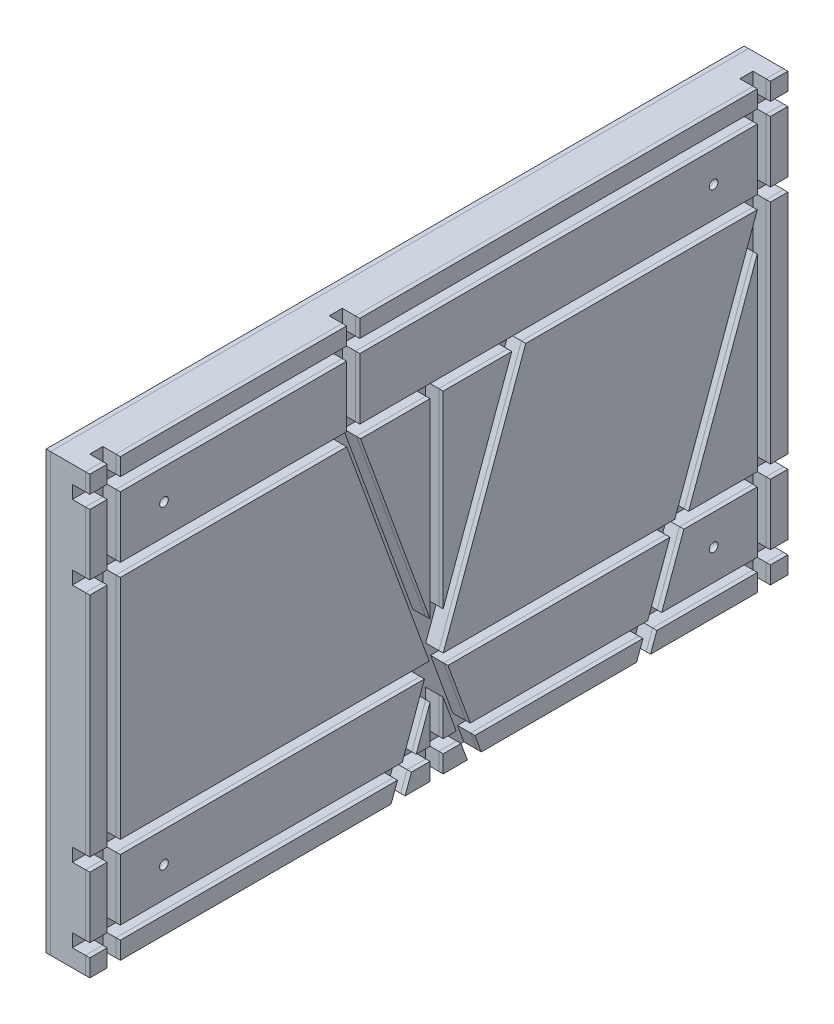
SolidWorks part; units mm, degrees
ref_plane "Plan de face" through (0, 0, 0) normal (0, 0, 1) x (1, 0, 0)
ref_plane "Plan de dessus" through (0, 0, 0) normal (0, 1, 0) x (1, 0, 0)
ref_plane "Plan de droite" through (0, 0, 0) normal (1, 0, 0) x (0, 0, -1)
sketch "Esquisse1" plane through (0, 0, 0) normal (1, 0, 0) x (0, 0, -1)
  line L1 (0, 0) -> (160, 0)
  line L2 (0, 0) -> (0, 100)
  line L3 (0, 100) -> (160, 100)
  line L4 (160, 0) -> (160, 100)
  dimension "D1" = 160
  dimension "D2" = 100
extrude "Extrusion1" add sketch "Esquisse1" against normal blind 1
sketch "Esquisse2" plane through (-1, 0, 0) normal (1, 0, 0) x (0, 0, -1)
  line L1 (160, 100) -> (0, 100)
  line L2 (160, 100) -> (160, 0)
  line L3 (160, 0) -> (0, 0)
  line L4 (0, 100) -> (0, 0)
extrude "Extrusion4" add sketch "Esquisse2" against normal blind 8 separate body
sketch "Esquisse4" plane through (-9, 0, 0) normal (-1, 0, 0) x (0, 0, 1)
  line L1 (0, 100) -> (-160, 100)
  line L2 (0, 100) -> (0, 0)
  line L3 (0, 0) -> (-160, 0)
  line L4 (-160, 100) -> (-160, 0)
extrude "Extrusion5" add sketch "Esquisse4" along normal blind 1 separate body
sketch "Esquisse5" plane through (0, 0, 0) normal (1, 0, 0) x (0, 0, -1)
  line L0 (160, 0) -> (160, 100) construction
  line L1 (156, 108.4085) -> (153, 108.4085)
  line L2 (156, 108.4085) -> (156, -9.5945)
  line L3 (156, -9.5945) -> (153, -9.5945)
  line L4 (153, 108.4085) -> (153, -9.5945)
  line L5 (0, 100) -> (0, 0) construction
  line L10 (7, 107.0249) -> (4, 107.0249)
  line L11 (7, 107.0249) -> (7, -7.0249)
  line L12 (7, -7.0249) -> (4, -7.0249)
  line L13 (4, 107.0249) -> (4, -7.0249)
  line L14 (0, 0) -> (160, 0) construction
  line L15 (81, 78) -> (78, 78)
  line L16 (81, 78) -> (81, -9.5945)
  line L17 (81, -9.5945) -> (78, -9.5945)
  line L18 (78, 78) -> (78, -9.5945)
  dimension "D1" = 3
  dimension "D2" = 4
  dimension "D4" = 3
  dimension "D5" = 4
  dimension "D7" = 3
  dimension "D8" = 79
  dimension "D9" = 78
extrude "Enlèv. mat.-Extru.1" cut sketch "Esquisse5" against normal blind 4
sketch "Esquisse6" plane through (0, 0, 0) normal (1, 0, 0) x (0, 0, -1)
  line L1 (165.6856, 96) -> (-8.2552, 96)
  line L2 (165.6856, 96) -> (165.6856, 93)
  line L3 (165.6856, 93) -> (-8.2552, 93)
  line L4 (-8.2552, 96) -> (-8.2552, 93)
  line L6 (164.4997, 79) -> (-14.778, 79)
  line L7 (164.4997, 79) -> (164.4997, 76)
  line L8 (164.4997, 76) -> (-14.778, 76)
  line L9 (-14.778, 79) -> (-14.778, 76)
  line L10 (168.0576, 4) -> (-9.6388, 4)
  line L11 (168.0576, 4) -> (168.0576, 7)
  line L12 (168.0576, 7) -> (-9.6388, 7)
  line L13 (-9.6388, 4) -> (-9.6388, 7)
  line L14 (7, 0) -> (153, 0) construction
  line L16 (165.6856, 24) -> (-9.6388, 24)
  line L17 (165.6856, 24) -> (165.6856, 21)
  line L18 (165.6856, 21) -> (-9.6388, 21)
  line L19 (-9.6388, 24) -> (-9.6388, 21)
  dimension "D1" = 3
  dimension "D4" = 3
  dimension "D5" = 3
  dimension "D6" = 4
  dimension "D7" = 3
  dimension "D8" = 21
extrude "Enlèv. mat.-Extru.3" cut sketch "Esquisse6" against normal blind 4
sketch "Esquisse7" plane through (0, 0, 0) normal (1, 0, 0) x (0, 0, -1)
  line L0 (125.3383, 0) -> (153, 76)
  line L1 (81, 0) -> (153, 0) construction
  line L2 (153, 76) -> (153, 24) construction
  line L3 (153.9311, 69.7867) -> (128.2731, -0.708)
  line L5 (128.2731, -0.708) -> (125.3383, 0)
  line L6 (153, 76) -> (153.9311, 69.7867)
  line L7 (81, 24) -> (99.9265, 76)
  line L8 (81, 76) -> (153, 76) construction
  line L9 (81, 24) -> (81, 76) construction
  line L10 (97.398, 77.8245) -> (68.7961, -0.7586)
  line L11 (81, 24) -> (72.2647, 0)
  line L12 (7, 0) -> (78, 0) construction
  line L13 (78, 21) -> (78, 7) construction
  line L14 (97.398, 77.8245) -> (99.9265, 76)
  line L15 (68.7961, -0.7586) -> (72.2647, 0)
  dimension "D1" = 20
  dimension "D2" = 3
  dimension "D3" = 20
  dimension "D4" = 3
  dimension "D5" = 20
extrude "Enlèv. mat.-Extru.4" cut sketch "Esquisse7" against normal blind 4
sketch "Esquisse8" plane through (0, 0, 0) normal (1, 0, 0) x (0, 0, -1)
  line L0 (58.881, 76) -> (86.5428, 0)
  line L1 (7, 76) -> (78, 76) construction
  line L3 (58.881, 76) -> (58.881, 105.2122)
  line L4 (81, 0) -> (125.3383, 0) construction
  line L6 (61.881, 76.529) -> (91.7572, -5.5553)
  line L7 (58.881, 105.2122) -> (61.881, 105.2122)
  line L9 (61.881, 105.2122) -> (61.881, 76.529)
  line L11 (91.7572, -5.5553) -> (86.5428, 0)
  dimension "D4" = 3
extrude "Enlèv. mat.-Extru.5" cut sketch "Esquisse8" against normal blind 4
sketch "Esquisse9" plane through (0, 0, 0) normal (1, 0, 0) x (0, 0, -1)
  line L0 (160, 79) -> (160, 93) construction
  line L1 (153, 100) -> (61.881, 100) construction
  line L2 (160, 50) -> (0, 50) construction
  line L3 (160, 24) -> (160, 76) construction
  line L4 (0, 76) -> (0, 24) construction
  line L5 (0, 93) -> (0, 79) construction
  circle A0 centre (143, 86) radius 1
  circle A1 centre (17, 86) radius 1
  circle A2 centre (17, 14) radius 1
  circle A3 centre (143, 14) radius 1
  dimension "D1" = 17
  dimension "D3" = 2
  dimension "D2" = 14
  dimension "D4" = 17
extrude "Enlèv. mat.-Extru.6" cut sketch "Esquisse9" against normal through all
